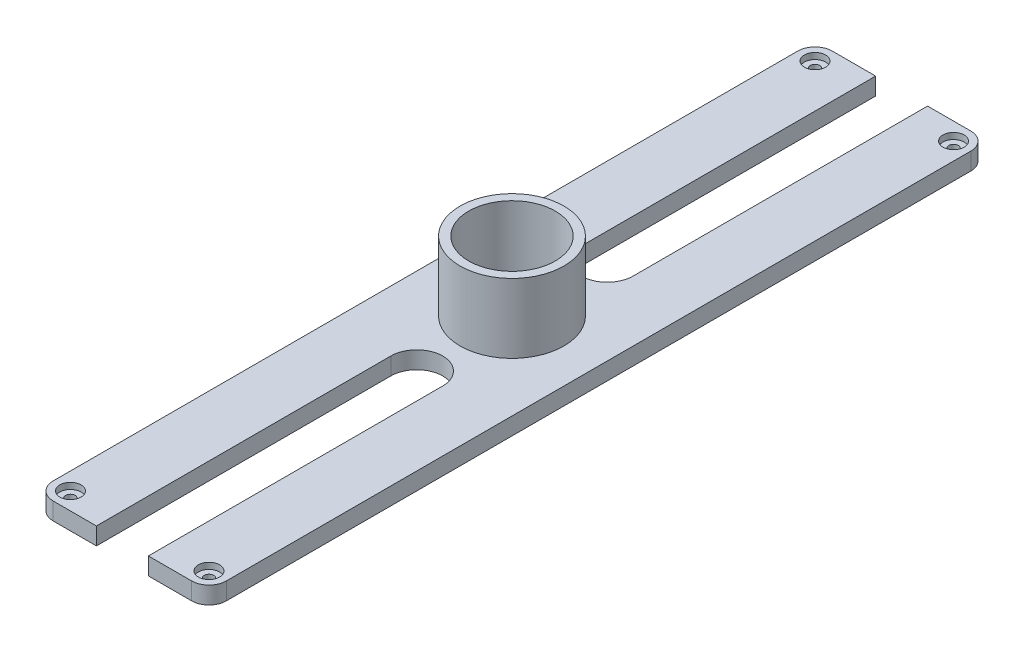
SolidWorks part; units mm, degrees
ref_plane "Front Plane" through (0, 0, 0) normal (0, 0, 1) x (1, 0, 0)
ref_plane "Top Plane" through (0, 0, 0) normal (0, 1, 0) x (1, 0, 0)
ref_plane "Right Plane" through (0, 0, 0) normal (1, 0, 0) x (0, 0, -1)
sketch "Sketch1" plane through (0, 0, 0) normal (0, 1, 0) x (0, 0, 1)
  line L0 (10, 0) -> (440, 0)
  line L1 (450, 10) -> (450, 90)
  line L2 (440, 100) -> (10, 100)
  line L3 (0, 90) -> (0, 10)
  arc A0 (10, 100) -> (0, 90) centre (10, 90) ccw
  arc A1 (10, 0) -> (0, 10) centre (10, 10) cw
  arc A2 (440, 0) -> (450, 10) centre (440, 10) ccw
  arc A3 (450, 90) -> (440, 100) centre (440, 90) ccw
  point P7 (0, 100)
  point P10 (0, 0)
  point P13 (450, 0)
  dimension "D3" = 10
  dimension "D1" = 450
  dimension "D2" = 100
extrude "Extrude1" add sketch "Sketch1" along normal blind 10
hole_wizard "CBORE for M5 Hex Head Bolt1" positions "Sketch4" profile "Sketch3" counterbore size "M5" standard "Ansi Metric"
sketch "Sketch4" plane through (0, 10, 0) normal (0, 1, 0) x (-1, 0, 0)
  point P0 (-90, 10)
  point P1 (-90, 440)
  point P4 (-10, 440)
  point P7 (-10, 10)
sketch "Sketch3" plane through (90, 10, 10) normal (1, 0, 0) x (0, 0, 1)
  line L0 (0, 0) -> (0, 10)
  line L1 (0, 10) -> (2.75, 10)
  line L3 (2.75, 10) -> (2.75, 3.58)
  line L4 (2.75, 3.58) -> (6.12, 3.58)
  line L5 (6.12, 3.58) -> (6.12, 0)
  line L7 (6.12, 0) -> (0, 0)
  line L11 (0, -6.35) -> (0, 107.95) construction
  dimension "Thru Hole Dia." = 5.5
  dimension "Thru Hole Depth" = 10
  dimension "C'Bore Dia." = 12.24
  dimension "C'Bore Depth" = 3.58
sketch "Sketch5" plane through (0, 10, 0) normal (0, 1, 0) x (-1, 0, 0)
  line L0 (0, 225) -> (-100, 225) construction
  line L3 (0, 10) -> (0, 440) construction
  line L4 (-100, 440) -> (-100, 10) construction
  circle A0 centre (-50, 225) radius 30
  circle A1 centre (-50, 225) radius 25
  dimension "D1" = 60
  dimension "D2" = 5
extrude "Extrude2" add sketch "Sketch5" along normal blind 40
sketch "Sketch6" plane through (0, 10, 0) normal (0, 1, 0) x (-1, 0, 0)
  line L0 (-90, 0) -> (-10, 0) construction
  line L2 (-35, 0) -> (-35, 170)
  line L3 (-65, 170) -> (-65, 0)
  line L4 (-65, 0) -> (-35, 0)
  line L5 (-50, 225) -> (-50, 0) construction
  line L6 (-50, 225) -> (-138.6387, 225) construction
  line L7 (-65, 450) -> (-35, 450)
  line L8 (-65, 280) -> (-65, 450)
  line L9 (-35, 450) -> (-35, 280)
  arc A0 (-35, 170) -> (-65, 170) centre (-50, 170) ccw
  arc A1 (-35, 280) -> (-65, 280) centre (-50, 280) cw
  dimension "D2" = 15
  dimension "D1" = 170
extrude "Cut-Extrude1" cut sketch "Sketch6" against normal up to next
